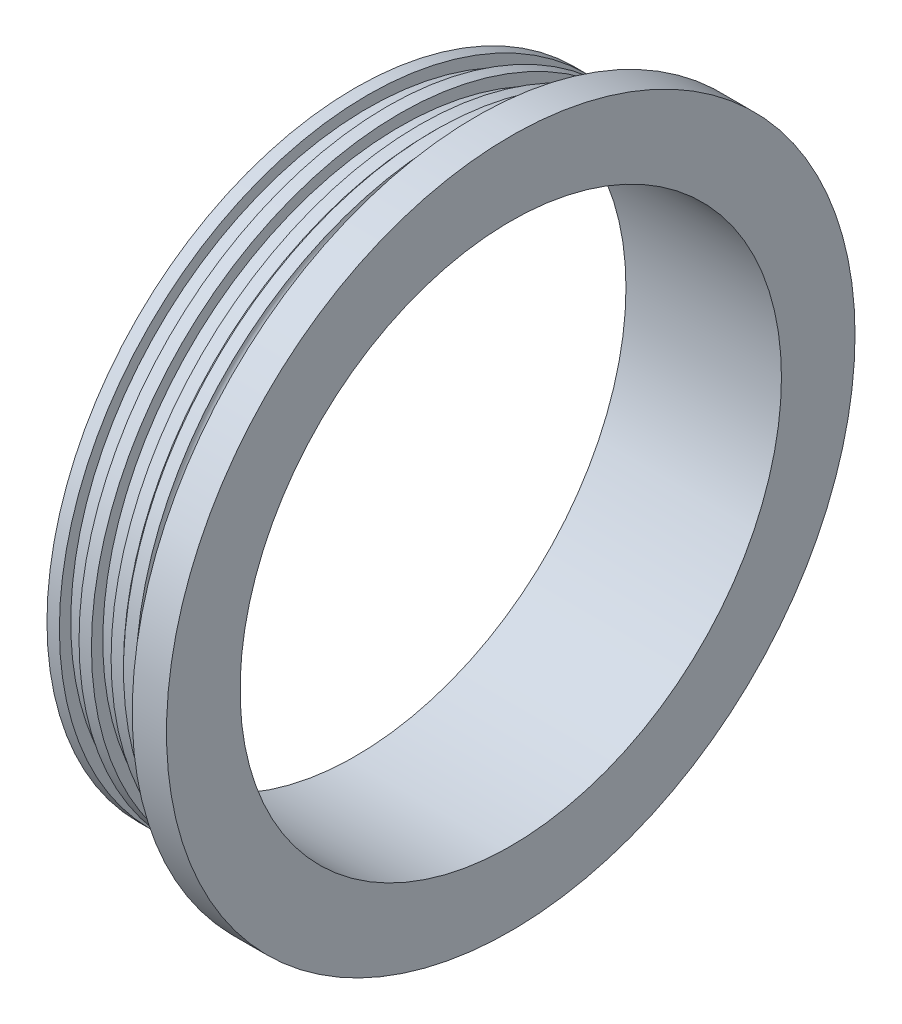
SolidWorks part; units mm, degrees
ref_plane "Front Plane" through (0, 0, 0) normal (0, 0, 1) x (1, 0, 0)
ref_plane "Top Plane" through (0, 0, 0) normal (0, 1, 0) x (1, 0, 0)
ref_plane "Right Plane" through (0, 0, 0) normal (1, 0, 0) x (0, 0, -1)
sketch "Sketch2" plane through (0, 0, 0) normal (0, 1, 0) x (1, 0, 0)
  line L0 (0, 0) -> (0, 83.185)
  line L1 (0, 65.405) -> (-34.3916, 65.405)
  line L2 (-17.1958, 65.405) -> (-17.1958, 71.755)
  line L3 (-34.3916, 65.405) -> (-34.3916, 71.755)
  line L4 (-34.3916, 71.755) -> (0, 71.755)
  line L5 (-34.3916, 71.755) -> (-34.3916, 74.4982)
  line L6 (-34.3916, 74.4982) -> (-31.3944, 74.4982)
  line L7 (-31.3944, 74.4982) -> (-31.3944, 71.755)
  line L8 (-23.6474, 74.4982) -> (-23.6474, 71.755)
  line L9 (-26.6446, 74.4982) -> (-26.6446, 71.755)
  line L10 (-18.8976, 74.4982) -> (-18.8976, 71.755)
  line L11 (-15.9004, 71.755) -> (-15.9004, 74.4982)
  line L12 (-15.1384, 74.4982) -> (-15.1384, 71.755)
  line L13 (0, 0) -> (-47.7348, 0)
  line L15 (-5.1054, 75.2602) -> (-5.1054, 83.185)
  line L16 (-5.1054, 83.185) -> (0, 83.185)
  line L17 (-26.6446, 74.4982) -> (-23.6474, 74.4982)
  line L18 (-18.8976, 74.4982) -> (-15.1384, 74.4982)
  line L19 (-15.1384, 74.4982) -> (-15.1384, 75.2602)
  line L20 (-15.9004, 74.4982) -> (-15.1384, 75.2602)
  line L21 (-15.1384, 75.2602) -> (-12.1412, 75.2602)
  line L23 (-8.5598, 75.2602) -> (0, 75.2602)
  arc A0 (-12.1412, 75.2602) -> (-8.5598, 75.2602) centre (-10.3505, 75.2602) ccw
  point P19 (-18.8976, 73.1266)
  dimension "D16" = 3.5814
  dimension "D1" = 83.185
  dimension "D2" = 65.405
  dimension "D3" = 34.3916
  dimension "D4" = 6.35
  dimension "D5" = 2.7432
  dimension "D6" = 2.9972
  dimension "D7" = 7.747
  dimension "D8" = 10.7442
  dimension "D9" = 15.494
  dimension "D10" = 18.4912
  dimension "D11" = 19.2532
  dimension "D14" = 29.2862
  dimension "D15" = 0.762
  dimension "D17" = 2.9972
revolve "Revolve1" add sketch "Sketch2" angle 360 about L13
sketch "Sketch3" plane through (0, 0, 0) normal (1, 0, 0) x (0, 0, -1)
  circle A0 centre (0, 0) radius 83.185
  circle A1 centre (0, 0) radius 65.405
extrude "Boss-Extrude1" add sketch "Sketch3" along normal blind 3.175
